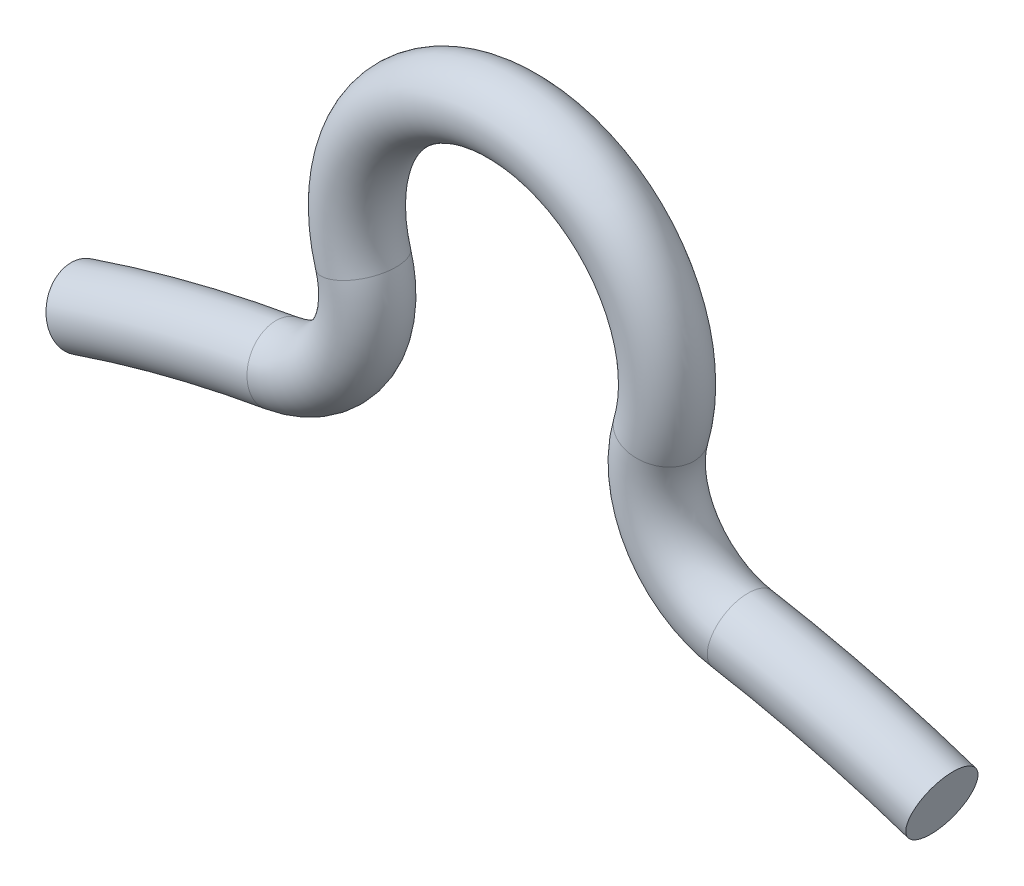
SolidWorks part; units mm, degrees
ref_plane "Plan de face" through (0, 0, 0) normal (0, 0, 1) x (1, 0, 0)
ref_plane "Plan de dessus" through (0, 0, 0) normal (0, 1, 0) x (1, 0, 0)
ref_plane "Plan de droite" through (0, 0, 0) normal (1, 0, 0) x (0, 0, -1)
sketch "Esquisse1" plane through (0, 0, 0) normal (0, 0, 1) x (1, 0, 0)
  line L0 (0, 0) -> (0, 687.8847) construction
  arc A0 (-125, 369.4252) -> (-66.9129, 384.2169) centre (0, 0) cw
  arc A1 (43.2725, 422.2146) -> (-43.2725, 422.2146) centre (0, 434.905) ccw
  arc A2 (66.9129, 384.2169) -> (125, 369.4252) centre (0, 0) cw
  arc A3 (-43.2725, 422.2146) -> (-66.9129, 384.2169) centre (-72.0601, 413.7721) cw
  arc A4 (43.2725, 422.2146) -> (66.9129, 384.2169) centre (72.0601, 413.7721) ccw
  point P12 (3.915, 389.9803)
  point P13 (0, 390)
  point P14 (0, 480)
  dimension "D1" = 390
  dimension "D2" = 90
  dimension "D3" = 30
  dimension "D4" = 60
  dimension "D5" = 390
  dimension "D6" = 250
ref_plane "Plan1" through (-125, 369.4252, 0) normal (0.9472, 0.3205, 0) x (0, 0, -1)
sketch "Esquisse2" plane through (-125, 369.4252, 0) normal (0.9472, 0.3205, 0) x (0, 0, -1)
  circle A0 centre (0, 0) radius 10
  dimension "D1" = 20
sweep "Balayage1" add profiles "Esquisse2" path "Esquisse1"
